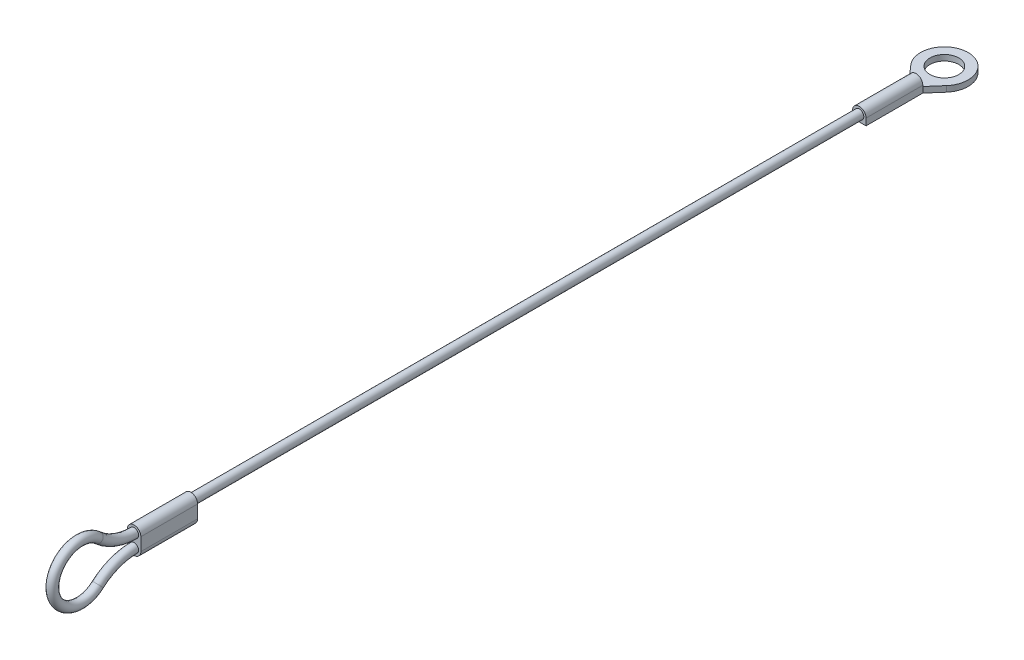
SolidWorks part; units mm, degrees
ref_plane "Front Plane" through (0, 0, 0) normal (0, 0, 1) x (1, 0, 0)
ref_plane "Top Plane" through (0, 0, 0) normal (0, 1, 0) x (1, 0, 0)
ref_plane "Right Plane" through (0, 0, 0) normal (1, 0, 0) x (0, 0, -1)
sketch "Sketch1" plane through (0, 0, 0) normal (1, 0, 0) x (0, 0, -1)
  line L2 (-127.8, 0) -> (0, 0)
  arc A0 (-127.8, 0) -> (-134.2, 2.4446) centre (-127.8, 9.6) cw
  arc A1 (-134.2, 2.4446) -> (-134.2, -4.7108) centre (-137.4, -1.1331) ccw
  arc A2 (-134.2, -4.7108) -> (-127.8, -2.2663) centre (-127.8, -11.8663) cw
  dimension "D1" = 4.8
  dimension "D4" = 9.6
  dimension "D2" = 137.4
  dimension "D3" = 9.6
sketch "Sketch2" plane through (0, 0, 0) normal (0, 0, 1) x (1, 0, 0)
  circle A0 centre (0, 0) radius 0.795
  dimension "D1" = 1.59
sweep "Sweep1" add profiles "Sketch2" path "Sketch1"
sketch "Sketch3" plane through (0, 0, 127.8) normal (0, 0, -1) x (-1, 0, 0)
  line L0 (0, 0) -> (0, -2.2663) construction
  line L1 (1.195, 0) -> (1.195, -2.2663)
  line L2 (-1.195, 0) -> (-1.195, -2.2663)
  line L3 (-0.795, -2.2663) -> (0.795, -2.2663) construction
  arc A0 (1.195, 0) -> (-1.195, 0) centre (0, 0) ccw
  arc A1 (-1.195, -2.2663) -> (1.195, -2.2663) centre (0, -2.2663) ccw
  point P3 (0, -1.1331)
  dimension "D1" = 2.39
extrude "Boss-Extrude1" add sketch "Sketch3" along normal blind 10
sketch "Sketch4" plane through (0, 0, 0) normal (0, 0, -1) x (-1, 0, 0)
  line L0 (-1.195, 0) -> (-1.195, -1.195)
  line L1 (-1.195, -1.195) -> (0, -1.195)
  line L2 (0, -1.195) -> (1.195, -1.195)
  line L3 (1.195, -1.195) -> (1.195, 0)
  arc A0 (1.195, 0) -> (-1.195, 0) centre (0, 0) ccw
  dimension "D1" = 2.39
extrude "Boss-Extrude2" add sketch "Sketch4" along normal blind 10
sketch "Sketch5" plane through (0, -1.195, 0) normal (0, -1, 0) x (1, 0, 0)
  line L0 (-1.195, -10) -> (1.195, -10)
  line L1 (1.195, -10) -> (3.155, -12.2428)
  line L2 (-3.155, -12.2428) -> (-1.195, -10)
  arc A0 (3.155, -12.2428) -> (-3.155, -12.2428) centre (0, -15) cw
  circle A1 centre (0, -15) radius 2.54
  point P8 (-4.19, -15)
  point P9 (4.19, -15)
  dimension "D1" = 5.08
  dimension "D2" = 8.38
  dimension "D3" = 15
extrude "Boss-Extrude3" add sketch "Sketch5" against normal blind 1.01
